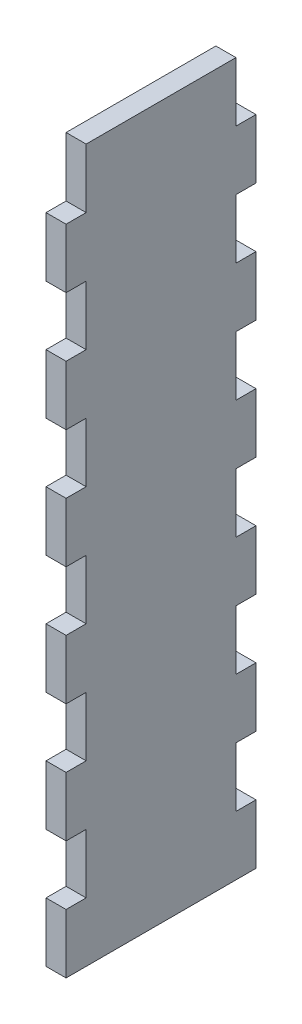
SolidWorks part; units mm, degrees
ref_plane "Front Plane" through (0, 0, 0) normal (0, 0, 1) x (1, 0, 0)
ref_plane "Top Plane" through (0, 0, 0) normal (0, 1, 0) x (1, 0, 0)
ref_plane "Right Plane" through (0, 0, 0) normal (1, 0, 0) x (0, 0, -1)
sketch "Sketch1" plane through (0, 0, 0) normal (1, 0, 0) x (0, 0, -1)
  line L1 (-16, 60) -> (16, 60)
  line L2 (-16, 60) -> (-16, -60)
  line L3 (-16, -60) -> (16, -60)
  line L4 (16, 60) -> (16, -60)
  line L5 (-16, 60) -> (16, -60) construction
  line L6 (-16, -60) -> (16, 60) construction
  point P0 (0, 0)
extrude "Boss-Extrude1" add sketch "Sketch1" along normal blind 3.38
sketch "Sketch2" plane through (3.38, 0, 0) normal (1, 0, 0) x (0, 0, -1)
  line L0 (-16, 60) -> (-12.62, 60)
  line L1 (16, 60) -> (-16, 60) construction
  line L2 (-12.62, 60) -> (-12.62, 50)
  line L3 (-12.62, 50) -> (-16, 50)
  line L4 (-16, 60) -> (-16, -60) construction
  line L5 (-16, 50) -> (-16, 40)
  line L6 (-16, 30) -> (-12.62, 30)
  line L7 (-12.62, 30) -> (-12.62, 40)
  line L8 (-12.62, 40) -> (-16, 40)
  line L9 (-16, 30) -> (-16, 20)
  line L10 (-16, 20) -> (-12.62, 20)
  line L11 (-12.62, 20) -> (-12.62, 10)
  line L12 (-12.62, 10) -> (-16, 10)
  line L13 (-16, 10) -> (-16, 0)
  line L14 (-16, 0) -> (-12.62, 0)
  line L15 (-12.62, 0) -> (-12.62, -10)
  line L16 (-12.62, -10) -> (-16, -10)
  line L17 (-16, -10) -> (-16, -20)
  line L18 (-16, -20) -> (-12.62, -20)
  line L19 (-12.62, -20) -> (-12.62, -30)
  line L20 (-12.62, -30) -> (-16, -30)
  line L21 (-16, -30) -> (-16, -40)
  line L22 (-16, -40) -> (-12.62, -40)
  line L23 (-12.62, -40) -> (-12.62, -50)
  line L24 (-12.62, -50) -> (-16, -50)
  line L25 (-16, 60) -> (-16, -50)
  line L26 (0, 60) -> (0, -60) construction
  line L27 (-16, -60) -> (16, -60) construction
  line L28 (12.62, -50) -> (16, -50)
  line L29 (12.62, -40) -> (12.62, -50)
  line L30 (16, -40) -> (12.62, -40)
  line L31 (12.62, -30) -> (16, -30)
  line L32 (12.62, -20) -> (12.62, -30)
  line L33 (16, -20) -> (12.62, -20)
  line L34 (12.62, -10) -> (16, -10)
  line L35 (12.62, 0) -> (12.62, -10)
  line L36 (16, 0) -> (12.62, 0)
  line L37 (12.62, 10) -> (16, 10)
  line L38 (12.62, 20) -> (12.62, 10)
  line L39 (16, 20) -> (12.62, 20)
  line L40 (16, 30) -> (12.62, 30)
  line L41 (12.62, 30) -> (12.62, 40)
  line L42 (12.62, 40) -> (16, 40)
  line L43 (16, 60) -> (16, -50)
  line L44 (12.62, 50) -> (16, 50)
  line L45 (12.62, 60) -> (12.62, 50)
  line L46 (16, 60) -> (12.62, 60)
extrude "Cut-Extrude1" cut sketch "Sketch2" against normal blind 3.38 contours L3 L2 M28 M29 | L45 L44 L43 M28 | L42 L41 L40 M27 | L7 L8 L6 M29 | L12 L11 L10 M29 | L39 L38 L37 M27 | L36 L35 L34 M27 | L16 L15 L14 M29 | L33 L32 L31 M27 | L20 L19 L18 M29 | L24 L23 L22 M29 | L30 L29 L28 M27
equation "\"length\" = 120mm"
equation "\"D1@Sketch4\"=\"length\"/12"
equation "\"D2@Sketch4\"=\"length\"/12"
equation "\"D3@Sketch4\"=\"length\"/12"
equation "\"D4@Sketch4\"=\"length\"/12"
equation "\"D5@Sketch4\"=\"length\"/12"
equation "\"D6@Sketch4\"=\"length\"/12"
equation "\"D7@Sketch4\"=\"length\"/12"
equation "\"D8@Sketch4\"=\"length\"/12"
equation "\"D9@Sketch4\"=\"length\"/12"
equation "\"D10@Sketch4\"=\"length\"/12"
equation "\"D11@Sketch4\"=\"length\"/12"
equation "\"thickness of material\"= 3.38mm"
equation "\"D12@Sketch4\"=\"thickness of material\""
equation "\"D13@Sketch4\"=\"thickness of material\""
equation "\"D14@Sketch4\"=\"thickness of material\""
equation "\"D15@Sketch4\"=\"thickness of material\""
equation "\"D16@Sketch4\"=\"thickness of material\""
equation "\"D17@Sketch4\"=\"thickness of material\""
equation "\"width\"= 130mm"
equation "\"D1@Sketch5\"=\"width\"/12"
equation "\"D2@Sketch5\"=\"width\"/12"
equation "\"D3@Sketch5\"=\"width\"/12"
equation "\"D4@Sketch5\"=\"width\"/12"
equation "\"D5@Sketch5\"=\"width\"/12"
equation "\"D6@Sketch5\"=\"width\"/12"
equation "\"D7@Sketch5\"=\"width\"/12"
equation "\"D8@Sketch5\"=\"width\"/12"
equation "\"D9@Sketch5\"=\"width\"/12"
equation "\"D10@Sketch5\"=\"width\"/12"
equation "\"D11@Sketch5\"=\"thickness of material\""
equation "\"D12@Sketch5\"=\"thickness of material\""
equation "\"D13@Sketch5\"=\"thickness of material\""
equation "\"D14@Sketch5\"=\"thickness of material\""
equation "\"D15@Sketch5\"=\"thickness of material\""
equation "\"D1@Sketch1\"=\"length\""
equation "\"D1@Boss-Extrude1\"=\"thickness of material\""
equation "\"D1@Sketch2\"=\"length\"/12"
equation "\"D7@Sketch2\"=\"length\"/12"
equation "\"D3@Sketch2\"=\"length\"/12"
equation "\"D8@Sketch2\"=\"length\"/12"
equation "\"D4@Sketch2\"=\"length\"/12"
equation "\"D9@Sketch2\"=\"length\"/12"
equation "\"D5@Sketch2\"=\"length\"/12"
equation "\"D10@Sketch2\"=\"length\"/12"
equation "\"D6@Sketch2\"=\"length\"/12"
equation "\"D11@Sketch2\"=\"length\"/12"
equation "\"D2@Sketch2\"=\"length\"/12"
equation "\"D12@Sketch2\"=\"thickness of material\""
equation "\"D13@Sketch2\"=\"thickness of material\""
equation "\"D14@Sketch2\"=\"thickness of material\""
equation "\"D15@Sketch2\"=\"thickness of material\""
equation "\"D16@Sketch2\"=\"thickness of material\""
equation "\"D17@Sketch2\"=\"thickness of material\""
equation "\"D1@Cut-Extrude1\"=\"thickness of material\""
